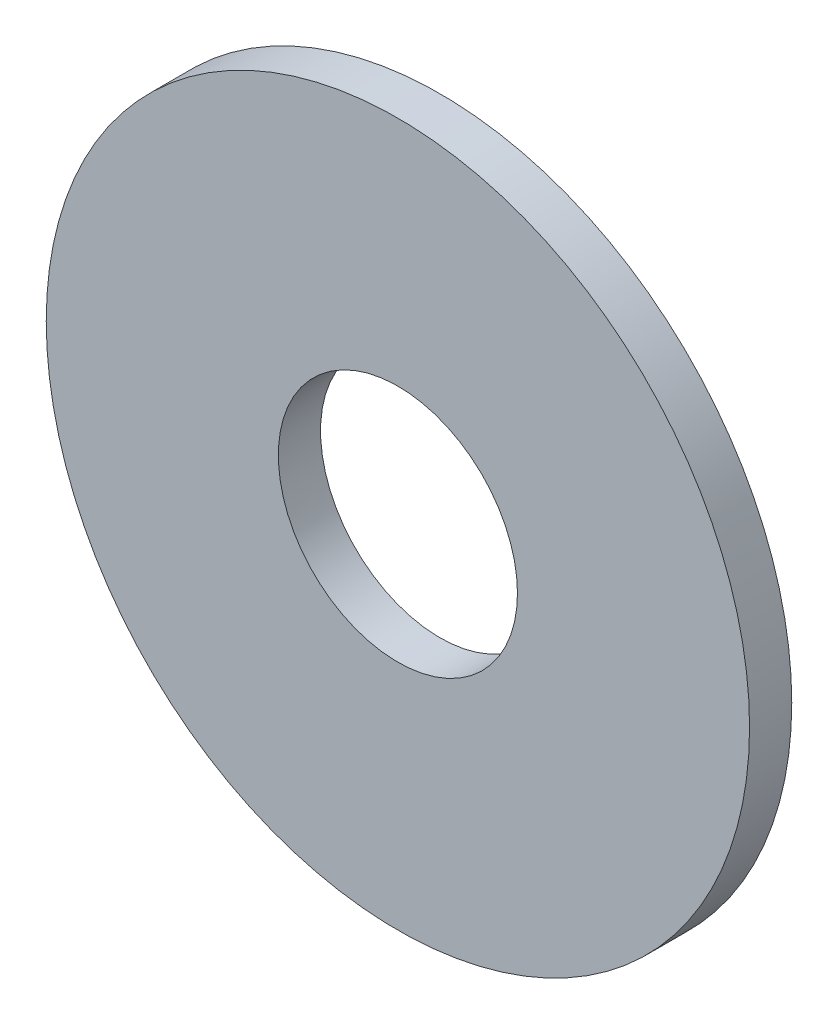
SolidWorks part; units mm, degrees
ref_plane "Piano frontale" through (0, 0, 0) normal (0, 0, 1) x (1, 0, 0)
ref_plane "Piano superiore" through (0, 0, 0) normal (0, 1, 0) x (1, 0, 0)
ref_plane "Piano destro" through (0, 0, 0) normal (1, 0, 0) x (0, 0, -1)
sketch "Schizzo1" plane through (0, 0, 0) normal (0, 0, 1) x (1, 0, 0)
  circle A0 centre (0, 0) radius 8.5
  circle A1 centre (0, 0) radius 25
  dimension "D1" = 50
  dimension "D2" = 17
extrude "Estrusione-Estrusione1" add sketch "Schizzo1" along normal blind 3
sketch "Linee di piegatura1" [suppressed] plane through (0, 0, 0) normal (0, 1, 0) x (1, 0, 0)
sketch "Casella di contorno1" [suppressed] plane through (0, 0, 0) normal (0, 1, 0) x (1, 0, 0)
equation "\"Lam_vern\"= 2 * ( \"SW-Massa\" / \"SW-Densità\" ) / ( \"Spessore\" / 1000 )"
